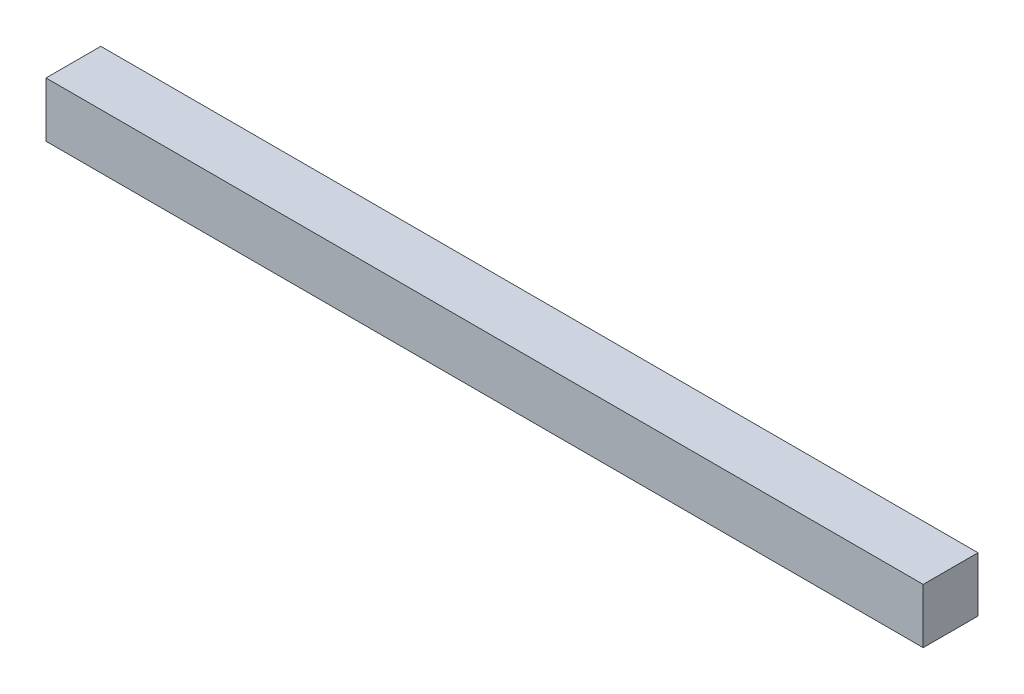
SolidWorks part; units mm, degrees
ref_plane "Front Plane" through (0, 0, 0) normal (0, 0, 1) x (1, 0, 0)
ref_plane "Top Plane" through (0, 0, 0) normal (0, 1, 0) x (1, 0, 0)
ref_plane "Right Plane" through (0, 0, 0) normal (1, 0, 0) x (0, 0, -1)
sketch "Sketch2" plane through (0, 0, 0) normal (1, 0, 0) x (0, 0, -1)
  line L1 (0, 0) -> (6.35, 0)
  line L2 (0, 0) -> (0, 6.35)
  line L3 (0, 6.35) -> (6.35, 6.35)
  line L4 (6.35, 0) -> (6.35, 6.35)
  dimension "D1" = 6.35
  dimension "D2" = 6.35
extrude "Extrude1" add sketch "Sketch2" along normal blind 101.6
